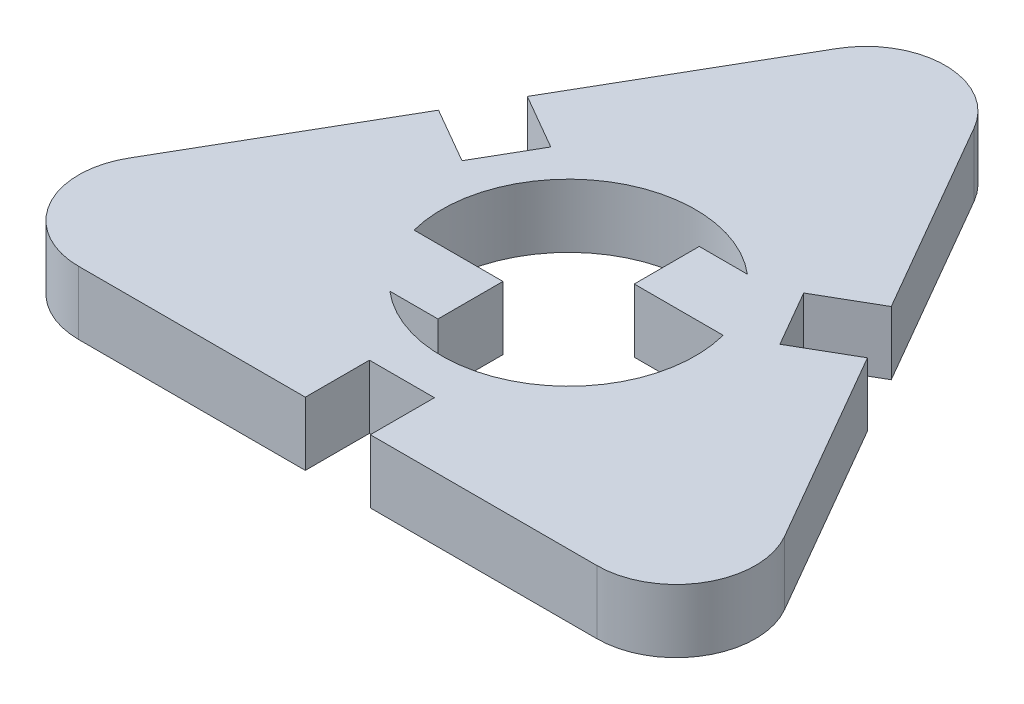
SolidWorks part; units mm, degrees
ref_plane "Alzado" through (0, 0, 0) normal (0, 0, 1) x (1, 0, 0)
ref_plane "Planta" through (0, 0, 0) normal (0, 1, 0) x (1, 0, 0)
ref_plane "Vista lateral" through (0, 0, 0) normal (1, 0, 0) x (0, 0, -1)
sketch "Croquis1" plane through (0, 0, 0) normal (0, 1, 0) x (1, 0, 0)
  line L0 (8, 0) -> (8, 2)
  line L1 (0, 28.7477) -> (-11.475, 8.8724)
  line L2 (-25, -14.5536) -> (-2.05, -14.5536)
  line L3 (25, -14.5536) -> (13.525, 5.3217)
  line L4 (7.746, 2) -> (2.14, 2)
  line L5 (2.14, 2) -> (2.14, 6.1)
  line L6 (2.14, 6.1) -> (5.1759, 6.1)
  line L7 (0, 0) -> (0, 5.2465) construction
  line L8 (0, 0) -> (-5.446, 0) construction
  line L9 (-8, -2) -> (-8, 2)
  line L10 (12.5541, 7.1282) -> (8.9994, 5.0759) construction
  line L11 (10.0244, 3.3006) -> (7.9744, 6.8513)
  line L12 (10.0244, 3.3006) -> (13.525, 5.3217)
  line L13 (-2.14, -6.1) -> (-5.1759, -6.1)
  line L14 (-2.14, -2) -> (-2.14, -6.1)
  line L15 (-7.746, -2) -> (-2.14, -2)
  line L16 (7.9744, 6.8513) -> (11.475, 8.8724)
  line L17 (11.475, 8.8724) -> (0, 28.7477)
  line L18 (-10.0244, 3.3006) -> (-7.9744, 6.8513)
  line L19 (-10.0244, 3.3006) -> (-13.525, 5.3217)
  line L20 (-7.9744, 6.8513) -> (-11.475, 8.8724)
  line L21 (-25, -14.5536) -> (-14.5217, -8.504) construction
  line L22 (-2.05, -10.5115) -> (-2.05, -14.5536)
  line L23 (-2.05, -10.5115) -> (2.05, -10.5115)
  line L24 (2.05, -10.5115) -> (2.05, -14.5536)
  line L25 (-13.525, 5.3217) -> (-25, -14.5536)
  line L26 (2.05, -14.5536) -> (25, -14.5536)
  arc A1 (-5.1759, -6.1) -> (7.746, 2) centre (0, 0) ccw
  arc A2 (5.1759, 6.1) -> (-7.746, -2) centre (0, 0) ccw
  point P23 (-8, 0)
  dimension "D2" = 22.95
  dimension "D1" = 22.95
  dimension "D3" = 22.95
  dimension "D4" = 90
  dimension "D5" = 4.1
  dimension "D6" = 22.95
  dimension "D7" = 22.95
extrude "Saliente-Extruir1" add sketch "Croquis1" along normal blind 4
fillet "Redondeo1" radius 5 3 edges at (25, 2, 14.5536) (-25, 2, 14.5536) (0, 2, -28.7477)
